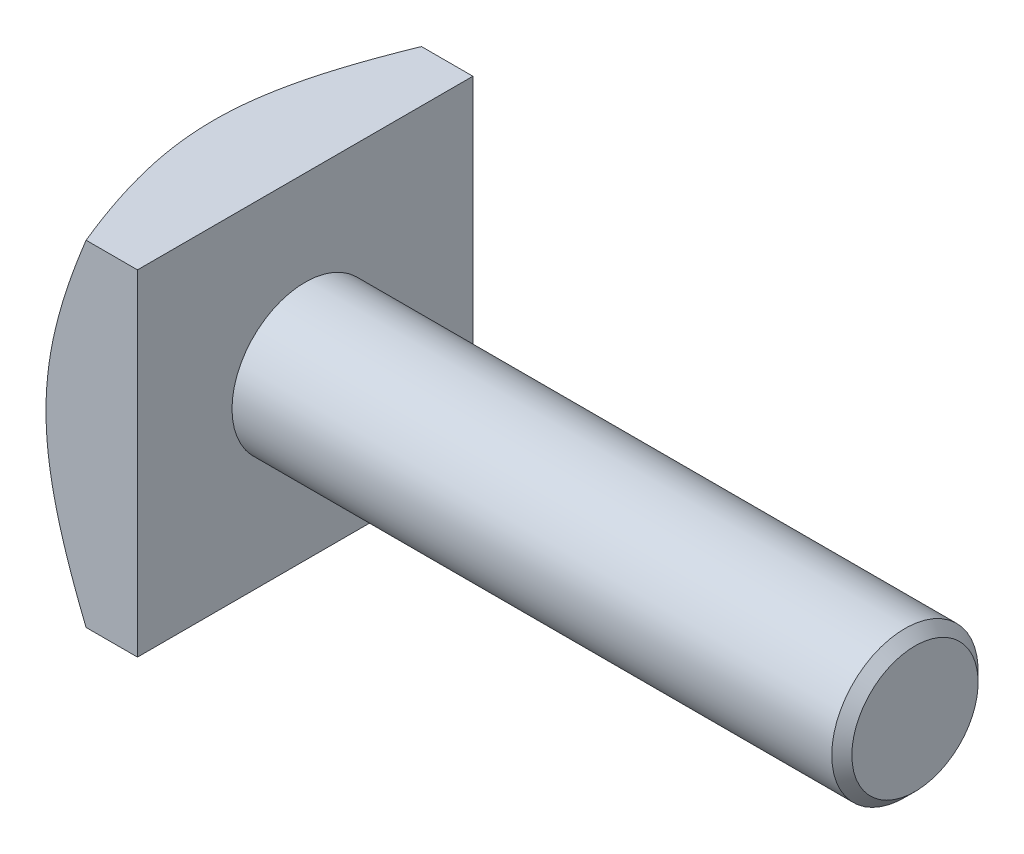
SolidWorks part; units mm, degrees
ref_plane "Plane1" through (0, 0, 0) normal (0, 0, 1) x (1, 0, 0)
ref_plane "Plane2" through (0, 0, 0) normal (0, 1, 0) x (1, 0, 0)
ref_plane "Plane3" through (0, 0, 0) normal (1, 0, 0) x (0, 0, -1)
sketch "Sketch1" plane through (0, 0, 0) normal (1, 0, 0) x (0, 0, -1)
  line L0 (27.5, 27.5) -> (27.5, -27.5)
  line L1 (-27.5, 27.5) -> (-27.5, -27.5)
  line L2 (0, 0) -> (22.2214, 0) construction
  line L3 (0, 0) -> (0, 20.1834) construction
  line L4 (-27.5, 27.5) -> (27.5, 27.5)
  line L5 (-27.5, -27.5) -> (27.5, -27.5)
  dimension "Width_flats" = 55
extrude "BaseHead" add sketch "Sketch1" along normal blind 15
sketch "BodySke" plane through (0, 0, 0) normal (0, 0, 1) x (1, 0, 0)
  line L0 (0, 27.5) -> (0, -27.5) construction
  line L1 (0, 0) -> (115, 0)
  line L2 (0, 0) -> (0, 12)
  line L3 (0, 12) -> (113.352, 12)
  line L4 (115, 0) -> (115, 10.352)
  line L6 (115, 10.352) -> (113.352, 12)
  line L7 (0, 0) -> (96.52, 0) construction
  line L8 (115, -10.352) -> (113.352, -12) construction
  line L9 (0, -12) -> (113.352, -12) construction
  line L10 (18, 15.24) -> (18, -1.27) construction
  line L11 (61, 15.24) -> (61, -1.27) construction
  line L12 (15, 27.5) -> (15, -27.5) construction
  line L13 (15, 27.5) -> (15, -27.5) construction
  dimension "Length" = 100
  dimension "Body_ch_ang" = 45
  dimension "Diameter" = 24
  dimension "Minor_dia" = 20.704
  dimension "Advance" = 3
  dimension "Thread_nom" = 54
revolve "BaseBody" add sketch "BodySke"
fillet "HeadFillet" [suppressed] radius 0.8
sketch "Sketch3" plane through (0, 0, 0) normal (0, 0, 1) x (1, 0, 0)
  line L0 (0, 27.5) -> (8.0829, 41.5)
  line L2 (8.0829, 41.5) -> (8.0829, 42.5)
  line L3 (8.0829, 42.5) -> (-1, 42.5)
  line L4 (-1, 42.5) -> (-1, 27.5)
  line L5 (-1, 27.5) -> (0, 27.5)
  line L6 (0, 0) -> (99.06, 0) construction
  line L8 (15, 27.5) -> (0, 27.5) construction
  line L9 (0, 27.5) -> (0, -27.5) construction
  dimension "D2" = 15
  dimension "D3" = 1
  dimension "D4" = 1
  dimension "Head_ch_ang" = 30
revolve "HeadChamfer" cut sketch "Sketch3" angle 360 about L6
sketch "ThdSchSke" plane through (0, 0, 0) normal (0, 0, 1) x (1, 0, 0)
  line L0 (61, -10.352) -> (59.8461, -12)
  line L1 (61, -10.352) -> (62.1539, -12)
  line L2 (62.1539, -12) -> (62.1539, -15)
  line L3 (-3.175, 0) -> (5.1513, 0) construction
  line L5 (62.1539, -15) -> (59.8461, -15)
  line L6 (59.8461, -15) -> (59.8461, -12)
  dimension "Thread_minor" = 20.704
  dimension "Diameter" = 24
  dimension "Start" = 61
  dimension "SideAngle" = 55
  dimension "VeeAngle" = 70
  dimension "Overcut" = 30
revolve "ThreadSchematic" [suppressed] cut sketch "ThdSchSke" angle 360 about L3
pattern_linear "ThdSchPat" [suppressed]
equation "\"Thread_minor@ThreadCosmetic\" = \"Minor_dia@BodySke\""
equation "\"Thread_length@ThreadCosmetic\" = ((sgn( (\"Length@BodySke\" - \"Advance@BodySke\" * 2 ) - \"Thread_nom@BodySke\" )-1)*( (\"Length@BodySke\" - \"Advance@BodySke\" * 2 ) - \"Thread_nom@BodySke\" ))/-2+ \"Thread_nom@"
equation "\"Thread_minor@ThdSchSke\" = \"Minor_dia@BodySke\""
equation "\"Diameter@ThdSchSke\" = \"Diameter@BodySke\""
equation "\"Overcut@ThdSchSke\" = \"Diameter@BodySke\" * 1.25"
equation "\"Start@ThdSchSke\" = \"Head_ht@BaseHead\" + \"Length@BodySke\" - \"Thread_length@ThreadCosmetic\"  '---Non-countersunk---"
equation "\"Num_threads@ThdSchPat\" = int( \"Thread_length@ThreadCosmetic\" / \"Advance@BodySke\" + 0.999 )  + 1"
equation "\"Advance@ThdSchPat\" = \"Thread_length@ThreadCosmetic\" /  (\"Num_threads@ThdSchPat\" - 1) 'relax it"
equation "\"Num_threads@ThdSchPat\" = \"Num_threads@ThdSchPat\" - sgn( \"Num_threads@ThdSchPat\" - 1) '---chamfered tips only---"
